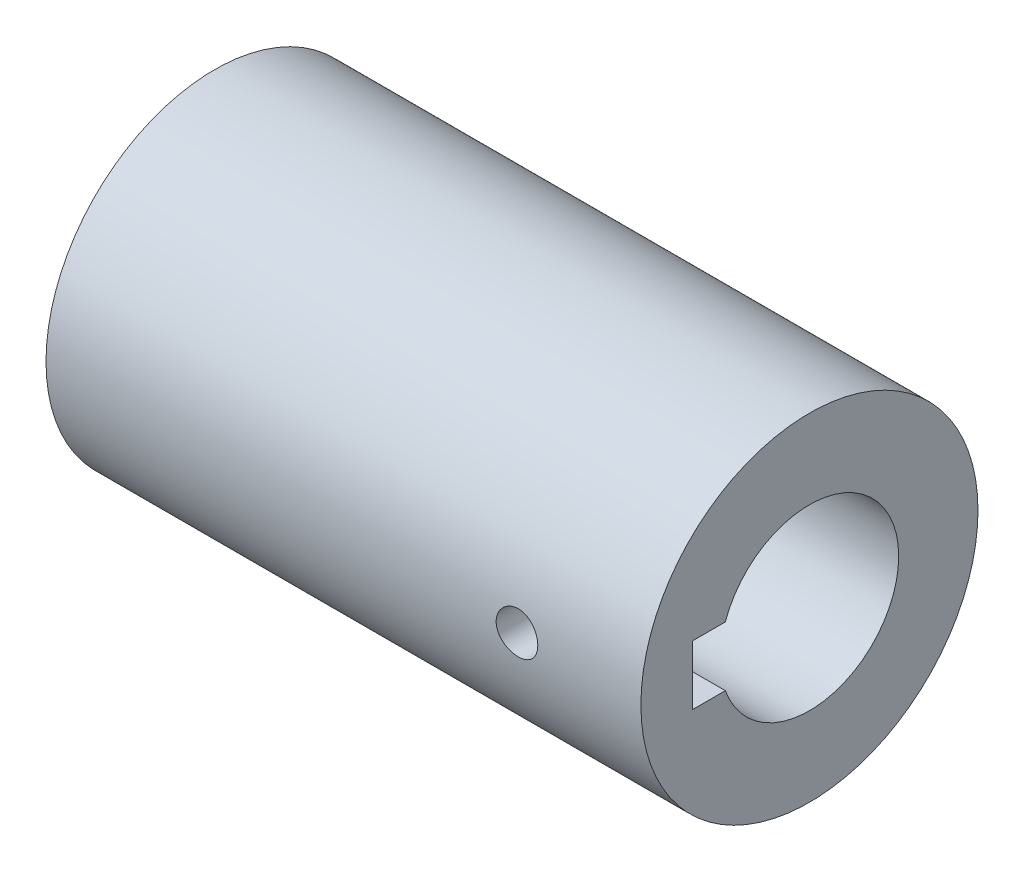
SolidWorks part; units mm, degrees
ref_plane "Front Plane" through (0, 0, 0) normal (1, 0, 0) x (0, 1, 0)
ref_plane "Top Plane" through (0, 0, 0) normal (0, 0, 1) x (0, 1, 0)
ref_plane "Right Plane" through (0, 0, 0) normal (0, 1, 0) x (-1, 0, 0)
sketch "Sketch1" plane through (0, 0, 0) normal (1, 0, 0) x (0, 1, 0)
  circle A0 centre (0, 0) radius 17
  dimension "D1" = 34
extrude "Coupler Body" add sketch "Sketch1" along normal mid plane 60
sketch "Sketch2" plane through (30, 0, 0) normal (1, 0, 0) x (0, 1, 0)
  circle A0 centre (0, 0) radius 9
  dimension "D1" = 18
extrude "Motor Bore" cut sketch "Sketch2" against normal blind 26 contours A0
sketch "Sketch4" plane through (-30, 0, 0) normal (-1, 0, 0) x (0, -1, 0)
  circle A0 centre (0, 0) radius 6.35
  dimension "D1" = 12.7
extrude "5-8 RH ACME - Tap Drill" cut sketch "Sketch4" against normal blind 26 contours A0
sketch "Sketch6" plane through (30, 0, 0) normal (1, 0, 0) x (0, 1, 0)
  line L0 (0, 0) -> (0, 9) construction
  line L1 (-3, 11.8) -> (3, 11.8)
  line L2 (-3, 11.8) -> (-3, 5.8)
  line L3 (-3, 5.8) -> (3, 5.8)
  line L4 (3, 11.8) -> (3, 5.8)
  line L5 (-3, 11.8) -> (3, 5.8) construction
  line L6 (-3, 5.8) -> (3, 11.8) construction
  circle A1 centre (0, 0) radius 9 construction
  point P0 (0, 8.8)
  dimension "D1" = 6
  dimension "D2" = 6
  dimension "D3" = 2.8
  dimension "D4" = 11.8
extrude "Keyway" cut sketch "Sketch6" against normal blind 26 contours L2 L3 L4 L1
ref_plane "Plane1" through (0, 0, 17) normal (0, 0, 1) x (0, -1, 0)
sketch "Sketch7" plane through (0, 0, 17) normal (0, 0, 1) x (0, -1, 0)
  line L0 (17, 30) -> (-17, 30) construction
  point P0 (0, 17.5)
  point P5 (0, 0)
  dimension "D1" = 12.5
hole_wizard "M5x0.8 Tapped Hole1" positions "Sketch7" profile "Sketch8" tap size "M5x0.8" standard "ANSI Metric"
sketch "Sketch8" plane through (17.5, 0, 17) normal (1, 0, 0) x (0, -1, 0)
  line L0 (0, 0) -> (0, 5.2)
  line L1 (0, 5.2) -> (2.1, 5.2)
  line L2 (2.1, 5.2) -> (2.1, 0)
  line L5 (2.1, 0) -> (0, 0)
  line L11 (0, -6.35) -> (0, 107.95) construction
  dimension "Thru Tap Drill Dia." = 4.2
  dimension "Thru Tap Drill Depth" = 5.2
